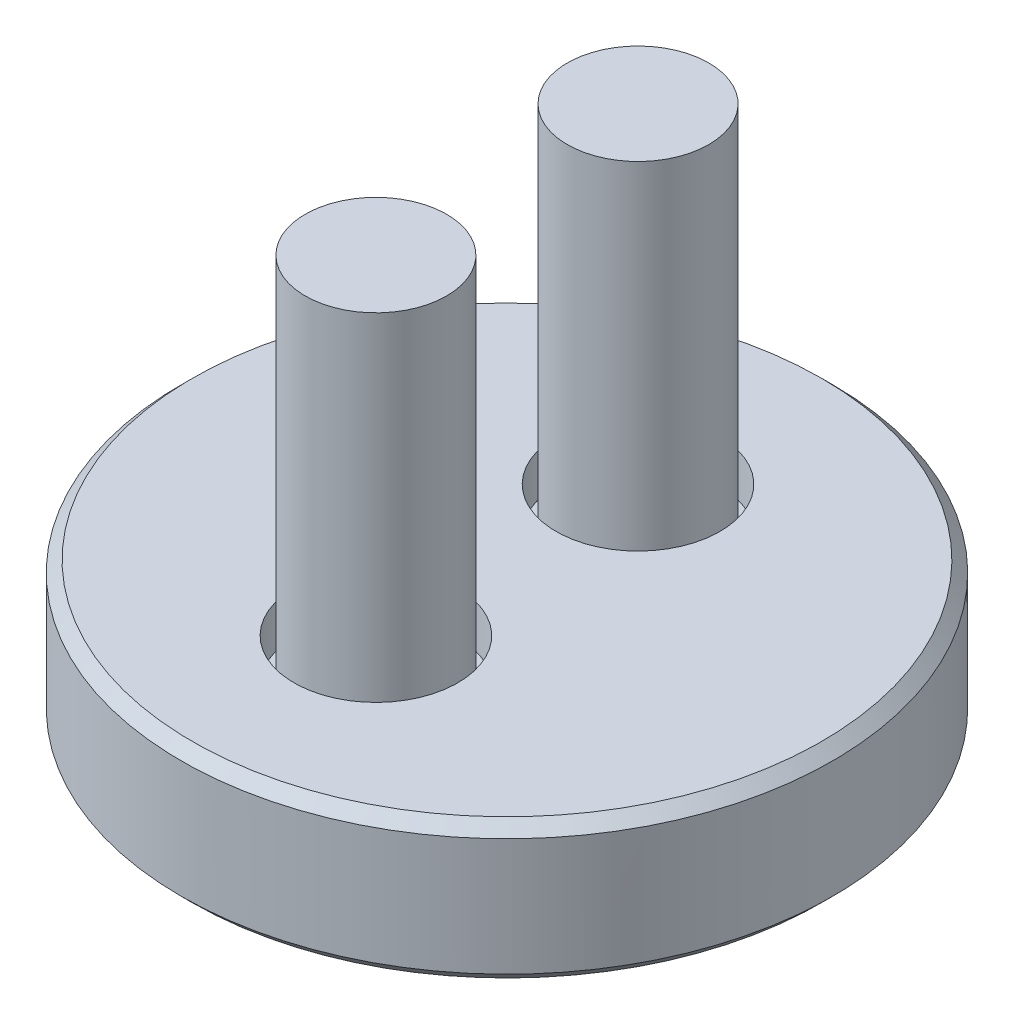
SolidWorks part; units mm, degrees
other "<LHCS10L.50>-<HEX>"
ref_plane "Front Plane" through (0, 0, 0) normal (0, 0, 1) x (1, 0, 0)
ref_plane "Top Plane" through (0, 0, 0) normal (0, 1, 0) x (1, 0, 0)
ref_plane "Right Plane" through (0, 0, 0) normal (1, 0, 0) x (0, 0, -1)
sketch "Sketch1" plane through (0, 0, 0) normal (0, 1, 0) x (1, 0, 0)
  circle A0 centre (0, 0) radius 11.1125
  dimension "D1" = 22.225
extrude "Extrude1" add sketch "Sketch1" along normal blind 4.7625
chamfer "Chamfer1" distance 0.381 angle 45 2 edges at (0, 0, 11.1125) (0, 4.7625, 11.1125)
sketch "Sketch2" plane through (0, 0, 0) normal (0, -1, 0) x (1, 0, 0)
  line L0 (0, 4.4704) -> (0, 0) construction
  line L1 (0, 0) -> (0, -4.4704) construction
  circle A0 centre (0, 4.4704) radius 2.794
  circle A1 centre (0, -4.4704) radius 2.794
  dimension "D1" = 5.588
  dimension "D2" = 4.4704
extrude "Extrude2" cut sketch "Sketch2" against normal through all
sketch "Sketch3" plane through (0, 0, 0) normal (0, -1, 0) x (1, 0, 0)
  line L0 (0, -4.4704) -> (0, 4.4704) construction
  line L1 (4.572, -4.4704) -> (4.572, 4.4704)
  line L2 (-4.572, -4.4704) -> (-4.572, 4.4704)
  arc A0 (4.572, -4.4704) -> (-4.572, -4.4704) centre (0, -4.4704) cw
  arc A1 (4.572, 4.4704) -> (-4.572, 4.4704) centre (0, 4.4704) ccw
  dimension "D1" = 4.572
  dimension "D2" = 4.572
extrude "Extrude3" cut sketch "Sketch3" against normal blind 3.302
inserted part "LHCS10L.50"
move or copy body "Body-Move/Copy2" placed by mates yes
mirror "Mirror1" about plane through (0, 0, 0) normal (0, 0, 1)
